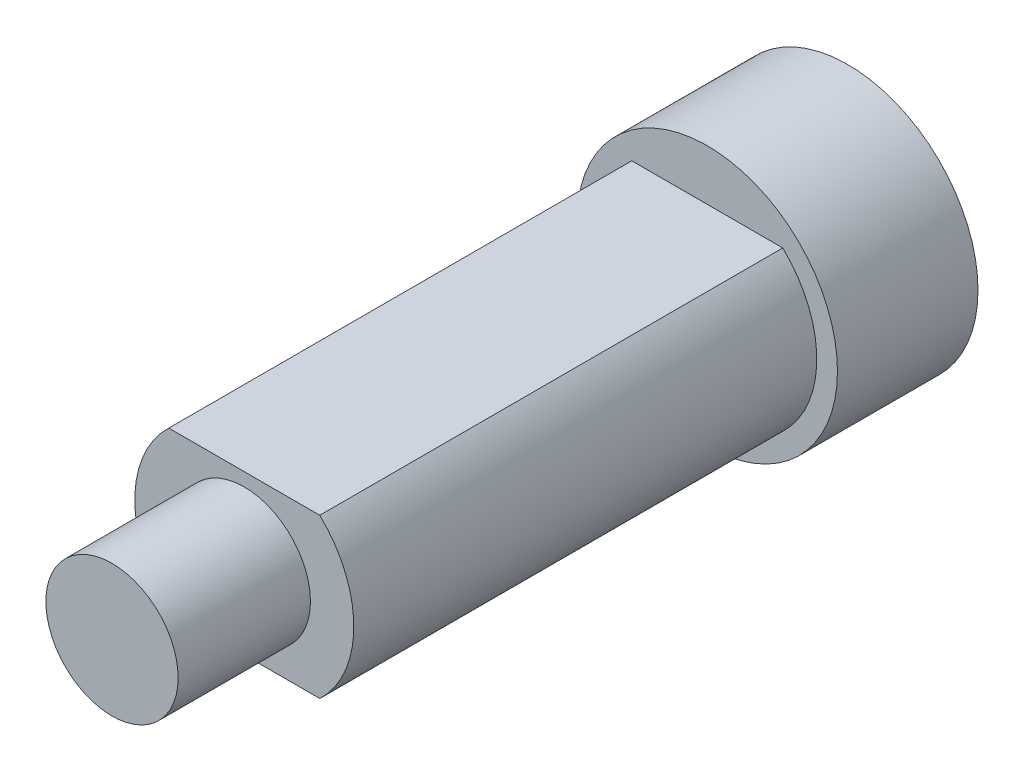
SolidWorks part; units mm, degrees
ref_plane "Front Plane" through (0, 0, 0) normal (0, 0, 1) x (1, 0, 0)
ref_plane "Top Plane" through (0, 0, 0) normal (0, 1, 0) x (1, 0, 0)
ref_plane "Right Plane" through (0, 0, 0) normal (1, 0, 0) x (0, 0, -1)
sketch "Sketch1" plane through (0, 0, 0) normal (0, 0, 1) x (1, 0, 0)
  circle A0 centre (0, 0) radius 12.5006
  dimension "D1" = 25.0012
extrude "Extrude1" add sketch "Sketch1" along normal blind 13.4925
sketch "Sketch2" plane through (0, 0, 13.4925) normal (0, 0, 1) x (1, 0, 0)
  line L2 (-7.2485, 7.62) -> (7.2485, 7.62)
  line L3 (-7.2485, -7.62) -> (7.2485, -7.62)
  arc A0 (-7.2485, 7.62) -> (-7.2485, -7.62) centre (0, 0) ccw
  arc A1 (7.2485, -7.62) -> (7.2485, 7.62) centre (0, 0) ccw
  dimension "D1" = 21.0337
extrude "Extrude2" add sketch "Sketch2" along normal blind 44.45
sketch "Sketch3" plane through (0, 0, 57.9425) normal (0, 0, 1) x (1, 0, 0)
  circle A0 centre (0, 0) radius 6.35
  dimension "D1" = 12.7
extrude "Extrude3" add sketch "Sketch3" along normal blind 12.7
